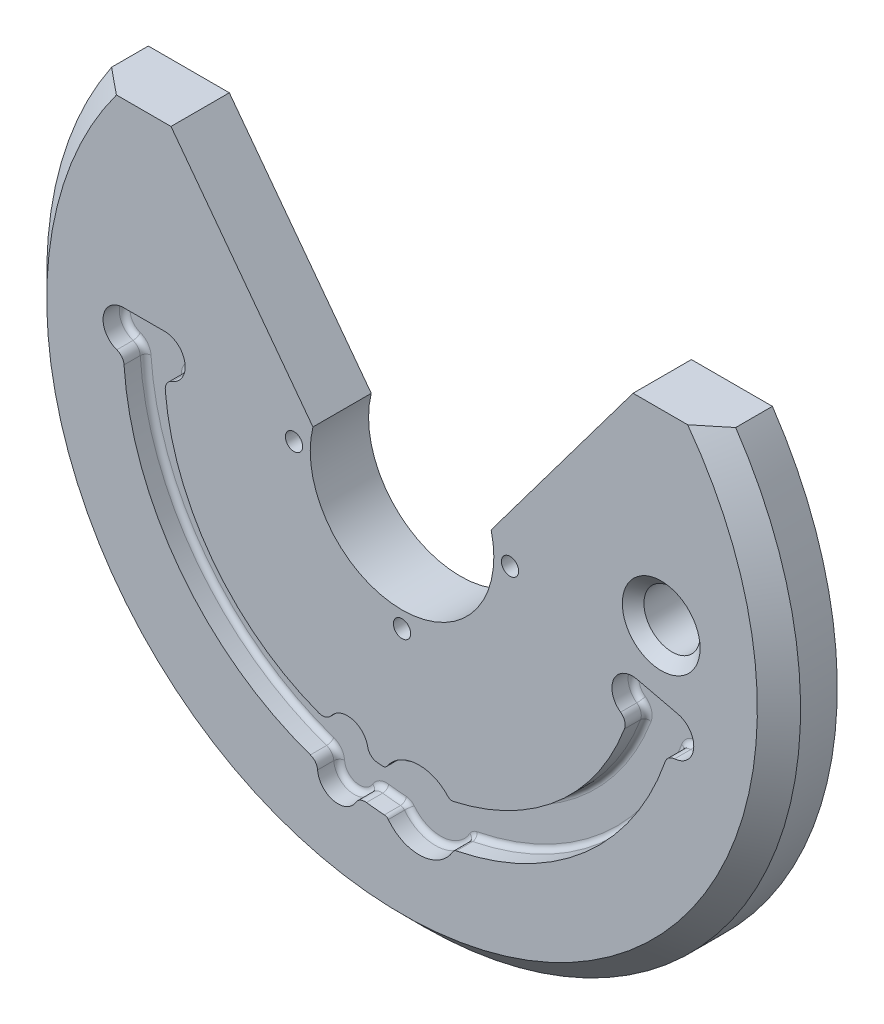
SolidWorks part; units mm, degrees
ref_plane "Front" through (0, 0, 0) normal (0, 0, 1) x (1, 0, 0)
ref_plane "Top" through (0, 0, 0) normal (0, 1, 0) x (1, 0, 0)
ref_plane "Right" through (0, 0, 0) normal (1, 0, 0) x (0, 0, -1)
sketch "Sketch1" plane through (0, 0, 0) normal (0, 0, 1) x (1, 0, 0)
  circle A0 centre (0, 0) radius 34.9
  circle A1 centre (0, 0) radius 8.5
  dimension "D1" = 69.8
  dimension "D2" = 17
extrude "Extrude1" add sketch "Sketch1" along normal blind 5.4
sketch "Sketch2" plane through (0, 0, 0) normal (0, 0, 1) x (1, 0, 0)
  line L0 (-28.8934, 19.5751) -> (27.6066, 19.5751) construction
  line L1 (30.9181, 19.5751) -> (21.3934, 19.5751)
  line L2 (-30.9181, 19.5751) -> (-21.3934, 19.5751)
  line L3 (-8.25, 2.0463) -> (8.25, 2.0463) construction
  line L4 (-8.25, 2.0463) -> (-21.3934, 19.5751)
  line L5 (8.25, 2.0463) -> (21.3934, 19.5751)
  circle A0 centre (0, 0) radius 34.9 construction
  circle A1 centre (0, 0) radius 8.5 construction
  arc A2 (-30.9181, 19.5751) -> (30.9181, 19.5751) centre (0, 0) cw
  arc A3 (-8.25, 2.0463) -> (8.25, 2.0463) centre (0, 0) ccw
  dimension "D1" = 56.5
  dimension "D3" = 7.5
  dimension "D4" = 16.5
extrude "Cut-Extrude1" cut sketch "Sketch2" along normal blind 6
sketch "Sketch3" plane through (0, 0, 5.4) normal (0, 0, 1) x (1, 0, 0)
  line L0 (-21.3934, 19.5751) -> (-28.8934, 19.5751) construction
  line L1 (-25.7825, 2.85) -> (-21.9795, 2.85)
  line L2 (0, 0) -> (-7.2175, -30.5975) construction
  line L3 (0, 0) -> (0, -46.1682) construction
  line L4 (0, 0) -> (27.2253, -6.422) construction
  line L5 (21.7686, -3.1827) -> (25.5471, -4.074)
  arc A0 (-23.7605, -1.3711) -> (23.7643, -1.3038) centre (0, 0) ccw construction
  arc A1 (-21.9233, -1.8356) -> (-7.7167, -20.6023) centre (0, 0) ccw
  arc A2 (-25.7426, -1.7206) -> (-8.4876, -24.3639) centre (0, 0) ccw
  arc A3 (-25.7825, 2.85) -> (-26.4101, -0.8434) centre (-25.7825, 0.95) ccw
  arc A4 (-21.2898, -0.8204) -> (-21.9795, 2.85) centre (-21.9795, 0.95) ccw
  arc A5 (-7.8188, -25.2402) -> (-4.2853, -26.0737) centre (-5.9233, -25.1108) ccw
  arc A6 (-3.1826, -21.0665) -> (-6.5676, -20.2681) centre (-5.0508, -21.4124) ccw
  arc A7 (-3.2955, -25.5887) -> (-1.6355, -25.7481) centre (0, 0) ccw
  arc A8 (-2.304, -21.879) -> (-1.8379, -21.9231) centre (0, 0) ccw
  arc A9 (4.2525, -21.3324) -> (-1.3841, -21.7081) centre (1.5826, -23.7473) ccw
  arc A10 (4.7308, -21.4853) -> (20.59, -7.7493) centre (0, 0) ccw
  arc A11 (5.0378, -25.3034) -> (24.3639, -8.4876) centre (0, 0) ccw
  arc A12 (-1.2708, -25.9423) -> (4.7021, -25.5442) centre (1.5826, -23.7473) ccw
  arc A13 (21.7686, -3.1827) -> (20.2328, -6.5815) centre (21.3324, -5.032) ccw
  arc A14 (25.2402, -7.8189) -> (25.5471, -4.074) centre (25.1109, -5.9233) ccw
  arc A16 (20.59, -7.7493) -> (20.2328, -6.5815) centre (19.6541, -7.397) ccw
  arc A17 (24.3639, -8.4876) -> (25.2402, -7.8189) centre (25.3083, -8.8165) cw
  arc A18 (-26.4101, -0.8434) -> (-25.7426, -1.7206) centre (-26.7403, -1.7873) cw
  arc A19 (-21.2898, -0.8204) -> (-21.9233, -1.8356) centre (-20.9268, -1.7522) ccw
  arc A20 (-6.5676, -20.2681) -> (-7.7167, -20.6023) centre (-7.3659, -19.6658) cw
  arc A21 (-3.1826, -21.0665) -> (-2.304, -21.879) centre (-2.1993, -20.8845) ccw
  arc A22 (-8.4876, -24.3639) -> (-7.8188, -25.2402) centre (-8.8165, -25.3083) cw
  arc A23 (-3.2955, -25.5887) -> (-4.2853, -26.0737) centre (-3.4232, -26.5805) ccw
  arc A24 (4.7308, -21.4853) -> (4.2525, -21.3324) centre (4.6233, -20.997) cw
  arc A25 (-1.8379, -21.9231) -> (-1.3841, -21.7081) centre (-1.7961, -21.4248) ccw
  arc A26 (-1.6355, -25.7481) -> (-1.2708, -25.9423) centre (-1.6672, -26.2471) cw
  arc A27 (5.0378, -25.3034) -> (4.7021, -25.5442) centre (5.1354, -25.7938) ccw
  point P56 (-1.4009, -25.7619)
  dimension "D1" = 23.8
  dimension "D2" = 22
  dimension "D3" = 25.8
  dimension "D4" = 3.8
  dimension "D5" = 3.8
  dimension "D6" = 3.8
  dimension "D7" = 7.2
  dimension "D8" = 3.8
  dimension "D9" = 1
  dimension "D10" = 1
  dimension "D11" = 1
  dimension "D12" = 0.5
extrude "Cut-Extrude2" cut sketch "Sketch3" against normal blind 2
fillet "Fillet1" radius 0.5 28 edges at (19.6009, -4.2496, 3.4) (23.6578, -3.6284, 3.4) (27.0045, -6.0784, 3.4) (24.7016, -8.0216, 3.4) (16.9354, -19.4636, 3.4) (4.8439, -25.3875, 3.4) (1.822, -27.3394, 3.4) (-1.4322, -25.8058, 3.4) (-2.4668, -25.6818, 3.4) (-3.8633, -25.6825, 3.4) (-6.3595, -26.9601, 3.4) (-8.0216, -24.7016, 3.4) (-20.5209, -15.6376, 3.4) (-25.9445, -1.1817, 3.4) (-27.6557, 1.2683, 3.4) (-23.881, 2.85, 3.4) (-20.1122, 1.3009, 3.4) (-21.7751, -1.2228, 3.4) (-17.5408, -13.2786, 3.4) (-7.0866, -20.626, 3.4) (-4.6146, -19.5631, 3.4) (-2.8782, -21.6187, 3.4) (-2.0711, -21.9023, 3.4) (-1.5821, -21.8767, 3.4) (1.3432, -20.1553, 3.4) (4.4711, -21.4733, 3.4) (14.4033, -16.6296, 3.4) (20.6104, -7.1045, 3.4)
sketch "Sketch4" plane through (0, 0, 5.4) normal (0, 0, 1) x (1, 0, 0)
  line L0 (0, 0) -> (0, -11.5527) construction
  line L1 (0, 0) -> (12.3541, 0) construction
  line L2 (0, 0) -> (-11.4078, 0) construction
  arc A0 (-10, 0) -> (10, 0) centre (0, 0) ccw construction
  circle A1 centre (-10, 0) radius 0.8
  circle A2 centre (0, -10) radius 0.8
  circle A3 centre (10, 0) radius 0.8
  dimension "D1" = 10
  dimension "D2" = 1.6
  dimension "D3" = 1.6
  dimension "D4" = 1.6
extrude "Cut-Extrude3" cut sketch "Sketch4" against normal blind 6
sketch "Sketch5" plane through (0, 0, 0) normal (0, 1, 0) x (1, 0, 0)
  line L0 (-20.3708, -4.6559) -> (-10.8164, -1.8675) construction
ref_plane "Plane1" through (-20.3708, 0, 4.6559) normal (0.96, 0, -0.2802) x (-0.2802, 0, -0.96)
sketch "Sketch6" plane through (-20.3708, 0, 4.6559) normal (0.96, 0, -0.2802) x (-0.2802, 0, -0.96)
  circle A0 centre (0, 0) radius 0.6
  dimension "D1" = 1.2
extrude "Cut-Extrude4" cut sketch "Sketch6" along normal blind 11 and the other way blind 1
sketch "Sketch7" plane through (0, 0, 0) normal (1, 0, 0) x (0, 0, -1)
  line L0 (-4.5712, -20.4897) -> (-1.8, -10.7403) construction
  line L1 (0, -34.9) -> (0, 19.5751) construction
  dimension "D1" = 1.8
ref_plane "Plane2" through (0, -20.4897, 4.5712) normal (0, 0.9619, -0.2734) x (-1, 0, 0)
sketch "Sketch8" plane through (0, -20.4897, 4.5712) normal (0, 0.9619, -0.2734) x (-1, 0, 0)
  circle A0 centre (0, 0) radius 0.6
  dimension "D1" = 1.2
extrude "Cut-Extrude5" cut sketch "Sketch8" along normal blind 11 and the other way blind 1.5
sketch "Sketch9" plane through (0, 0, 0) normal (0, 0, 1) x (1, 0, 0)
  arc A0 (23.7093, 4.3236) -> (24.1003, 0) centre (0, 0) cw construction
  circle A1 centre (23.9971, 2.228) radius 2.6
  dimension "D1" = 5.2
extrude "Cut-Extrude7" cut sketch "Sketch9" along normal blind 10
chamfer "Chamfer1" distance 1 distance2 1 1 edges at (26.5971, 2.228, 5.4)
chamfer "Chamfer2" distance 2 distance2 2 1 edges at (0, -34.9, 5.4)
